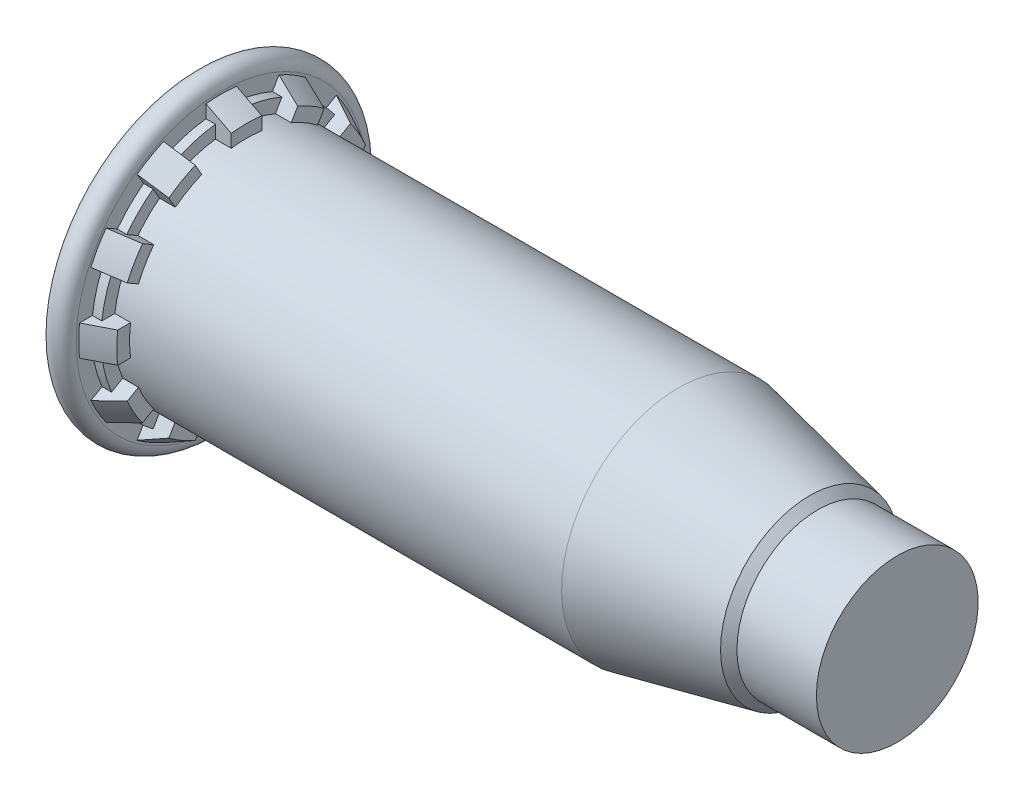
SolidWorks part; units mm, degrees
ref_plane "Plane1" through (0, 0, 0) normal (0, 0, 1) x (1, 0, 0)
ref_plane "Plane2" through (0, 0, 0) normal (0, 1, 0) x (1, 0, 0)
ref_plane "Plane3" through (0, 0, 0) normal (1, 0, 0) x (0, 0, -1)
sketch "BodySke" plane through (0, 0, 0) normal (0, 0, 1) x (1, 0, 0)
  line L0 (0, 0) -> (0, 3.9345)
  line L1 (0.6858, 3.9395) -> (0.6858, 3.8735)
  line L2 (0.6858, 3.8735) -> (1.3716, 3.5242)
  line L3 (1.3716, 3.175) -> (13.1064, 3.175)
  line L5 (19.05, 0) -> (0, 0)
  line L6 (0, 0) -> (50.554, 0) construction
  line L7 (1.3716, 3.5242) -> (1.3716, 3.175)
  line L8 (16.6688, 2.4193) -> (13.1064, 3.175)
  line L9 (-9.525, 4.2799) -> (9.525, 4.2799) construction
  line L11 (2.6416, 19.05) -> (2.6416, -3.175) construction
  line L12 (19.05, 2.1971) -> (19.05, 0)
  line L13 (9.525, -4.2799) -> (-9.525, -4.2799) construction
  line L14 (0.0051, 3.9395) -> (0.0051, 3.9345)
  line L15 (0, 3.9345) -> (0.0051, 3.9345)
  line L16 (16.891, 2.1971) -> (19.05, 2.1971)
  line L17 (16.6688, 2.4193) -> (16.891, 2.1971)
  arc A0 (0.0051, 3.9395) -> (0.6858, 3.9395) centre (0.3454, 3.9395) cw
  dimension "D2" = 0.0051
  dimension "D1" = 0.0051
  dimension "Diameter" = 6.35
  dimension "D5" = 45
  dimension "Length" = 19.05
  dimension "Minor_dia" = 4.8387
  dimension "Advance" = 1.27
  dimension "H_dia" = 8.5598
  dimension "Shoulder_lower_dia" = 7.747
  dimension "Shoulder_upper_dia" = 7.0485
  dimension "Shoulder_ht" = 1.3716
  dimension "T_dim" = 0.6858
  dimension "Dog_dia" = 4.3942
  dimension "Dog_len" = 2.159
  dimension "Thread_trans" = 3.7846
revolve "BaseBody" add sketch "BodySke" angle 360 about L6
sketch "ThdSchSke" plane through (0, 0, 0) normal (0, 0, 1) x (1, 0, 0)
  line L0 (3.429, -2.4193) -> (2.8999, -3.175)
  line L1 (3.429, -2.4193) -> (3.9581, -3.175)
  line L2 (3.9581, -3.175) -> (3.9581, -3.9688)
  line L3 (-3.175, 0) -> (5.1513, 0) construction
  line L5 (3.9581, -3.9688) -> (2.8999, -3.9688)
  line L6 (2.8999, -3.9688) -> (2.8999, -3.175)
  line L7 (0, 3.9345) -> (0, -3.9345) construction
  dimension "Thread_minor" = 4.8387
  dimension "Diameter" = 6.35
  dimension "Start" = 3.429
  dimension "SideAngle" = 55
  dimension "VeeAngle" = 70
  dimension "Overcut" = 7.9375
revolve "ThreadSchematic" [suppressed] cut sketch "ThdSchSke" angle 360 about L3
pattern_linear "ThdSchPat" [suppressed]
sketch "RibCut1Ske" plane through (1.3716, 0, 0) normal (1, 0, 0) x (0, 0, -1)
  line L0 (0.4144, 3.1478) -> (0.4144, 4.2598)
  line L1 (1.215, 2.9333) -> (1.771, 3.8963)
  line L2 (0, 0) -> (0, 4.9784) construction
  line L3 (0, 0) -> (0.4144, 3.1478) construction
  line L4 (0, 0) -> (1.215, 2.9333) construction
  arc A1 (1.215, 2.9333) -> (0.4144, 3.1478) centre (0, 0) ccw
  arc A2 (1.771, 3.8963) -> (0.4144, 4.2598) centre (0, 0) ccw
  dimension "Inner_dia" = 6.35
  dimension "Outer_dia" = 8.5598
  dimension "Rib_root_half_angle" = 7.5
  dimension "Rib_root_gap_angle" = 15
  dimension "Angle" = 30
extrude "RibCut1" cut sketch "RibCut1Ske" against normal blind 0.4286
sketch "RibCut2Ske" plane through (1.3716, 0, 0) normal (1, 0, 0) x (0, 0, -1)
  line L0 (0.4144, 3.4998) -> (0.4144, 4.2598)
  line L1 (1.391, 3.2381) -> (1.771, 3.8963)
  line L2 (0.4144, 3.1478) -> (0.4144, 4.9596) construction
  line L3 (0, 0) -> (0, 5.0239) construction
  line L4 (0, 0) -> (0.4144, 3.1478) construction
  line L5 (0, 0) -> (1.215, 2.9333) construction
  line L6 (1.215, 2.9333) -> (2.1244, 4.5085) construction
  arc A1 (1.391, 3.2381) -> (0.4144, 3.4998) centre (0, 0) ccw
  arc A2 (1.771, 3.8963) -> (0.4144, 4.2598) centre (0, 0) ccw
  circle A4 centre (0, 0) radius 3.175 construction
  dimension "Inner_dia" = 7.0485
  dimension "Outer_dia" = 8.5598
  dimension "Rib_root_dia" = 6.35
  dimension "Rib_root_half_angle" = 7.5
  dimension "Rib_root_gap_angle" = 15
  dimension "Angle" = 30
extrude "RibCut2" cut sketch "RibCut2Ske" against normal blind 0.6858
pattern_circular "RibCutsPat" count 12 every 30 about axis through (0, 0, 0) along (1, 0, 0) of "RibCut2", "RibCut1"
equation "' \"Length@BodySke\" = 0.75"
equation "' \"H_dia@BodySke\" = 0.337"
equation "' \"Start@ThdSchSke\" = 0.135"
equation "' \"Dog_dia@BodySke\" = 0.173"
equation "' \"Dog_len@BodySke\" = 0.085"
equation "' \"Thread_trans@BodySke\" = 0.149"
equation "' \"Diameter@BodySke\" = 0.25"
equation "' \"Minor_dia@BodySke\" =0.1905"
equation "' \"Advance@BodySke\" = 0.05"
equation "\"T_dim@BodySke\" = \"Start@ThdSchSke\" * 0.2"
equation "\"Shoulder_ht@BodySke\" = \"Start@ThdSchSke\" * 0.4"
equation "\"Shoulder_lower_dia@BodySke\" = \"H_dia@BodySke\" - \"Start@ThdSchSke\" * 0.2 - .005"
equation "\"Shoulder_upper_dia@BodySke\" = ( \"Shoulder_lower_dia@BodySke\" + \"Diameter@BodySke\" ) /2"
equation "\"Num_ribs@RibCutsPat\" = 12"
equation "\"Angle@RibCutsPat\" = 360 / \"Num_ribs@RibCutsPat\""
equation "\"Angle@RibCut1Ske\" =\"Angle@RibCutsPat\""
equation "\"Rib_root_half_angle@RibCut1Ske\" = \"Angle@RibCut1Ske\" / 4"
equation "\"Rib_root_gap_angle@RibCut1Ske\" = \"Angle@RibCut1Ske\" - (2 * \"Rib_root_half_angle@RibCut1Ske\" )"
equation "\"Inner_dia@RibCut1Ske\" = \"Diameter@BodySke\""
equation "\"Outer_dia@RibCut1Ske\" = \"H_dia@BodySke\""
equation "\"Depth@RibCut1\" =  \"Start@ThdSchSke\" * 0.125"
equation "\"Angle@RibCut2Ske\" =\"Angle@RibCutsPat\""
equation "\"Rib_root_half_angle@RibCut2Ske\" = \"Angle@RibCut1Ske\" / 4"
equation "\"Rib_root_gap_angle@RibCut2Ske\" = \"Angle@RibCut1Ske\" - (2 * \"Rib_root_half_angle@RibCut1Ske\" )"
equation "\"Rib_root_dia@RibCut2Ske\" = \"Diameter@BodySke\""
equation "\"Inner_dia@RibCut2Ske\" = \"Shoulder_upper_dia@BodySke\""
equation "\"Outer_dia@RibCut2Ske\" = \"H_dia@BodySke\""
equation "\"Depth@RibCut2\" =  \"Start@ThdSchSke\" * 0.2"
equation "\"Thread_length@ThreadCosmetic\" = \"Length@BodySke\" - \"Start@ThdSchSke\"  - \"Dog_len@BodySke\"  - ( \"Minor_dia@BodySke\" - \"Dog_dia@BodySke\" ) / 2"
equation "\"Thread_minor@ThreadCosmetic\" = \"Minor_dia@BodySke\""
equation "\"Thread_minor@ThdSchSke\" = \"Minor_dia@BodySke\""
equation "\"Diameter@ThdSchSke\" = \"Diameter@BodySke\""
equation "\"Overcut@ThdSchSke\" = \"Diameter@BodySke\" * 1.25"
equation "\"Num_threads@ThdSchPat\" = int( \"Thread_length@ThreadCosmetic\" / \"Advance@BodySke\" + 0.999 )  + 1"
equation "\"Advance@ThdSchPat\" = \"Thread_length@ThreadCosmetic\" /  (\"Num_threads@ThdSchPat\" - 1) 'relax it"
equation "\"Num_threads@ThdSchPat\" = \"Num_threads@ThdSchPat\" - sgn( \"Num_threads@ThdSchPat\" - 1) '---chamfered tips only---"
